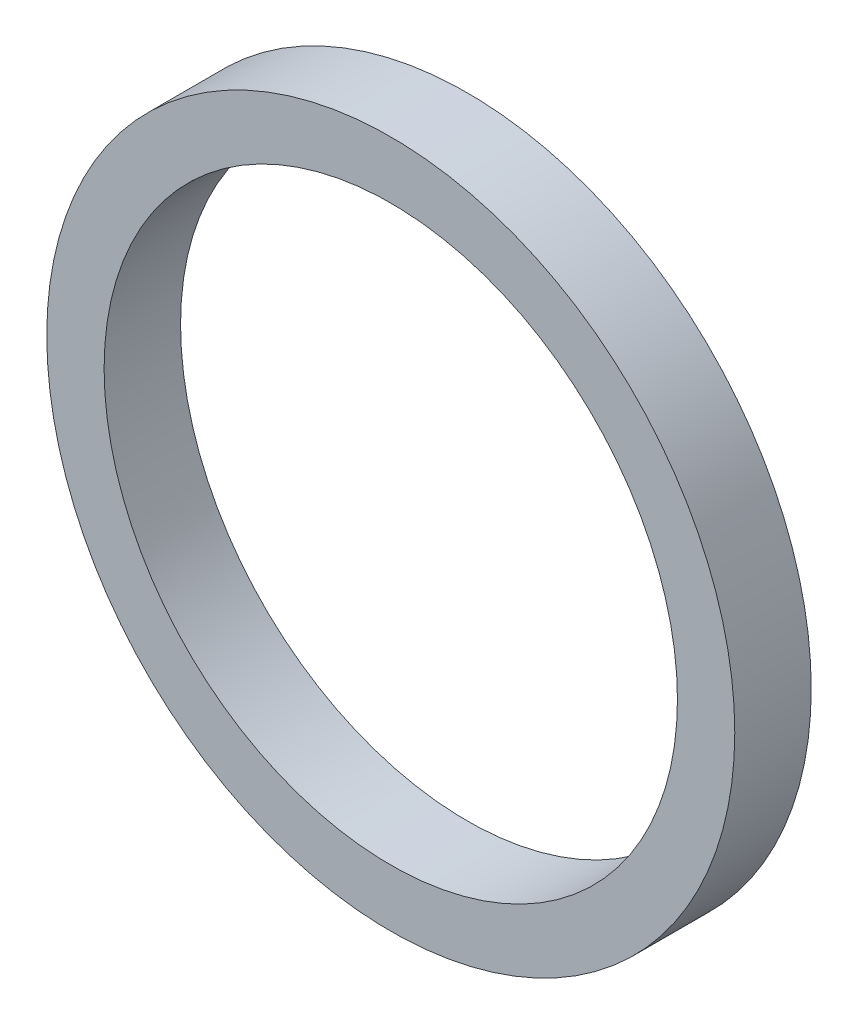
SolidWorks part; units mm, degrees
ref_plane "Front" through (0, 0, 0) normal (0, 0, 1) x (1, 0, 0)
ref_plane "Top" through (0, 0, 0) normal (0, 1, 0) x (1, 0, 0)
ref_plane "Right" through (0, 0, 0) normal (1, 0, 0) x (0, 0, -1)
other "Configuration Table"
sketch "Sketch1" plane through (0, 0, 0) normal (0, 0, 1) x (1, 0, 0)
  circle A0 centre (0, 0) radius 18
  circle A1 centre (0, 0) radius 15
  dimension "d" = 30
  dimension "D0" = 36
extrude "Base-Extrude" add sketch "Sketch1" against normal blind 4
